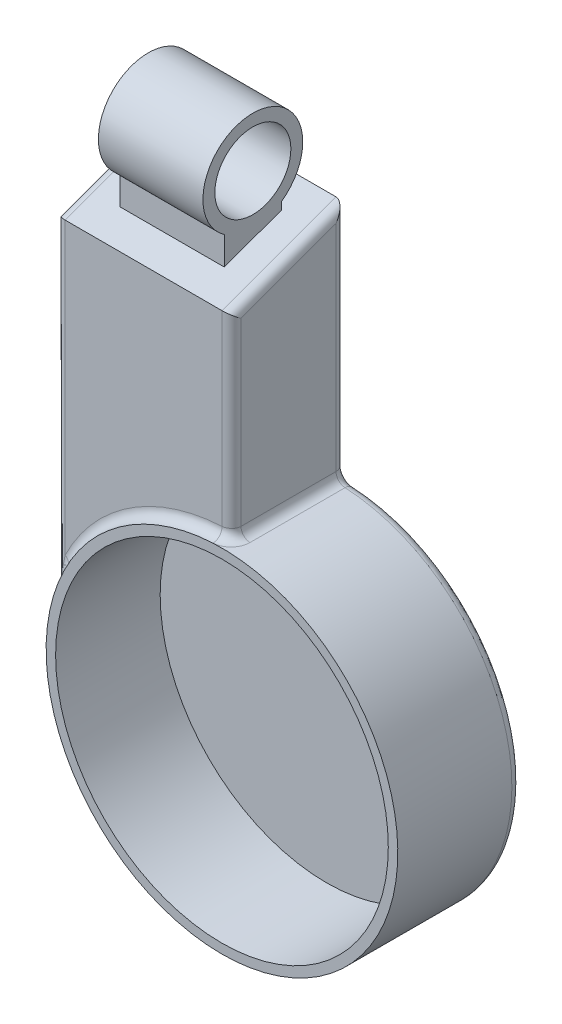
SolidWorks part; units mm, degrees
ref_plane "Plan de face" through (0, 0, 0) normal (0, 0, 1) x (1, 0, 0)
ref_plane "Plan de dessus" through (0, 0, 0) normal (0, 1, 0) x (1, 0, 0)
ref_plane "Plan de droite" through (0, 0, 0) normal (1, 0, 0) x (0, 0, -1)
sketch "Esquisse1" plane through (0, 0, 0) normal (0, 0, 1) x (1, 0, 0)
  circle A0 centre (0, 0) radius 18.5
  dimension "D1" = 37
extrude "Boss.-Extru.1" add sketch "Esquisse1" along normal blind 13
sketch "Esquisse2" plane through (0, 0, 0) normal (0, 1, 0) x (1, 0, 0)
  line L0 (-9.25, 2.2627) -> (-9.25, -17.2405) construction
  line L1 (-17.0567, -6) -> (-0.6385, -6) construction
  line L2 (18.5, 0) -> (-18.5, 0) construction
  line L3 (-18.5, 0) -> (0, 0)
  line L4 (-18.5, 0) -> (-18.5, -12)
  line L5 (-18.5, -12) -> (0, -12)
  line L6 (0, 0) -> (0, -12)
  line L7 (-18.5, 0) -> (0, -12) construction
  line L8 (-18.5, -12) -> (0, 0) construction
  line L9 (-18.5, 0) -> (-18.5, -13) construction
  point P4 (-9.25, -6)
  point P9 (-14.2451, -4.0185)
  dimension "D1" = 18.5
  dimension "D2" = 12
extrude "Boss.-Extru.2" add sketch "Esquisse2" along normal blind 43.5
sketch "Esquisse3" plane through (-18.5, 0, 0) normal (-1, 0, 0) x (0, 0, 1)
  line L0 (0, 43.5) -> (12, 39.1324)
  line L1 (12, 43.5) -> (12, 0) construction
  line L2 (12, 39.1324) -> (12, 43.5)
  line L3 (12, 43.5) -> (0, 43.5)
  dimension "D1" = 20
extrude "Enlèv. mat.-Extru.1" cut sketch "Esquisse3" against normal through all
fillet "Congé1" radius 1 9 edges at (-13.0815, 13.0815, 12) (13.0815, -13.0815, 0) (0, 18.5, 6) (0, 28.8162, 12) (0, 41.3162, 6) (0, 31, 0) (-18.5, 41.3162, 6) (-18.5, 21.75, 0) (-18.5, 19.5662, 12)
ref_plane "Plan1" through (0, 35, 0) normal (0, 1, 0) x (1, 0, 0)
sketch "Esquisse4" plane through (0, 35, 0) normal (0, 1, 0) x (1, 0, 0)
  line L0 (-18.5, -6) -> (0, -6) construction
  line L1 (-18.5, -11) -> (-18.5, -1) construction
  line L2 (0, -11) -> (0, -1) construction
  line L3 (-9.25, 0) -> (-9.25, -12) construction
  line L4 (-1, 0) -> (-17.5, 0) construction
  line L5 (-1, -12) -> (-17.5, -12) construction
  line L7 (-14.75, -9) -> (-3.75, -9)
  line L8 (-14.75, -9) -> (-14.75, -3)
  line L9 (-14.75, -3) -> (-3.75, -3)
  line L10 (-3.75, -9) -> (-3.75, -3)
  line L11 (-14.75, -9) -> (-3.75, -3) construction
  line L12 (-14.75, -3) -> (-3.75, -9) construction
  point P12 (-9.25, -6)
  dimension "D1" = 11
  dimension "D2" = 6
sketch "Esquisse5" plane through (0, 0, 0) normal (1, 0, 0) x (0, 0, -1)
  line L0 (11.1165, 47.5) -> (-23.3178, 47.5) construction
  line L1 (-7, -18.5) -> (10.5321, -18.5) construction
  line L2 (-13, -18.5) -> (-1, -18.5) construction
  line L3 (-6, 0) -> (-6, 54.0819) construction
  line L4 (-1, 0) -> (-11, 0) construction
  dimension "D1" = 66
extrude "Boss.-Extru.3" add sketch "Esquisse4" along normal blind 13
ref_plane "Plan2" through (-9.25, 0, 0) normal (1, 0, 0) x (0, 0, -1)
sketch "Esquisse6" plane through (-9.25, 0, 0) normal (1, 0, 0) x (0, 0, -1)
  line L0 (11.1165, 47.5) -> (-23.3178, 47.5) construction
  line L1 (-6, 0) -> (-6, 54.0819) construction
  circle A0 centre (-6, 47.5) radius 5.25
  circle A1 centre (-6, 47.5) radius 4
  dimension "D1" = 10.5
  dimension "D2" = 8
extrude "Boss.-Extru.4" add sketch "Esquisse6" along normal mid plane 11
sketch "Esquisse7" plane through (-3.75, 0, 0) normal (1, 0, 0) x (0, 0, -1)
  arc A0 (-3, 44.8542) -> (-9, 44.8542) centre (-6, 47.5) ccw construction
  circle A1 centre (-6, 47.5) radius 4
  point P3 (0, 0)
  point P4 (-3, 44.795)
extrude "Enlèv. mat.-Extru.2" cut sketch "Esquisse7" against normal through all
sketch "Esquisse8" plane through (0, 0, 13) normal (0, 0, 1) x (1, 0, 0)
  circle A0 centre (0, 0) radius 17.5
  dimension "D1" = 35
extrude "Enlèv. mat.-Extru.3" cut sketch "Esquisse8" against normal blind 11
